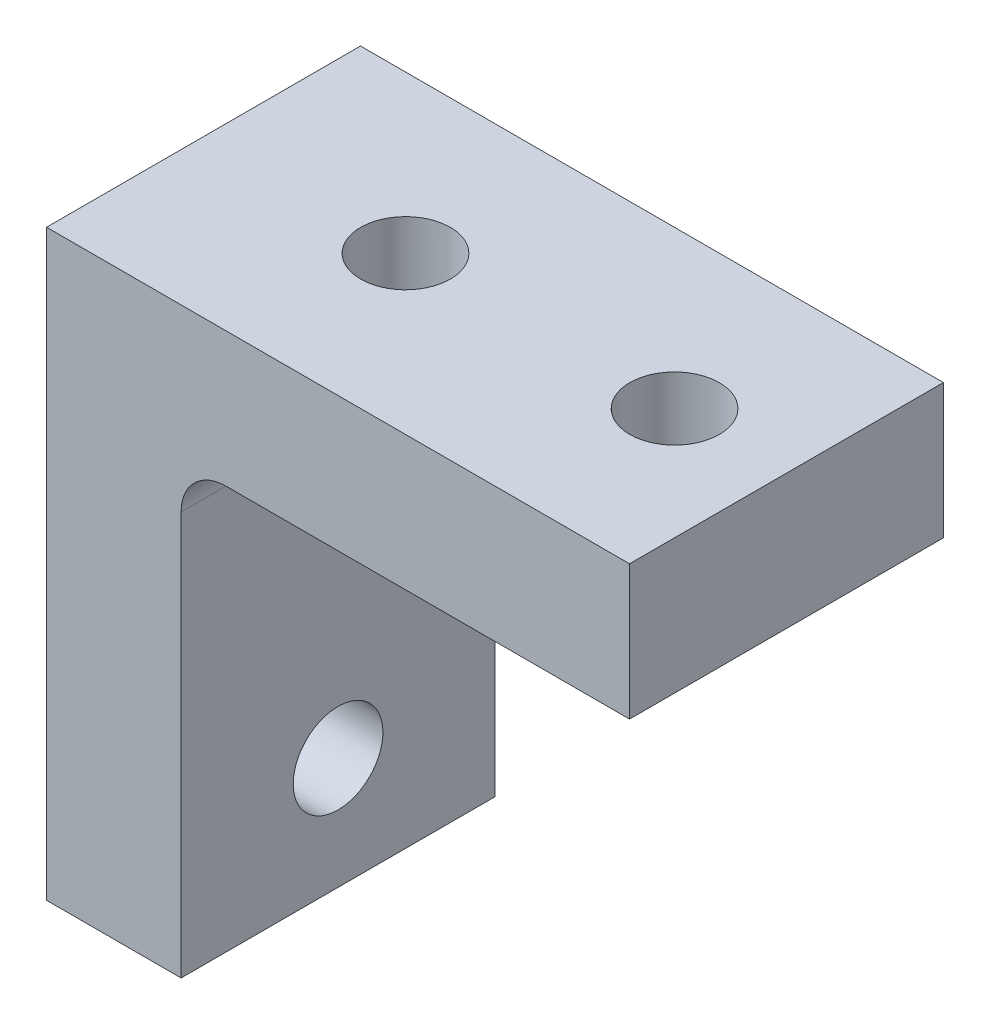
SolidWorks part; units mm, degrees
ref_plane "Front Plane" through (0, 0, 0) normal (0, 0, 1) x (1, 0, 0)
ref_plane "Top Plane" through (0, 0, 0) normal (0, 1, 0) x (1, 0, 0)
ref_plane "Right Plane" through (0, 0, 0) normal (1, 0, 0) x (0, 0, -1)
sketch "Sketch1" plane through (0, 0, 0) normal (0, 0, 1) x (1, 0, 0)
  line L0 (0, 0) -> (0, -41.275)
  line L1 (0, -41.275) -> (9.525, -41.275)
  line L2 (9.525, -41.275) -> (9.525, -9.525)
  line L3 (9.525, -9.525) -> (41.275, -9.525)
  line L4 (41.275, -9.525) -> (41.275, 0)
  line L5 (41.275, 0) -> (0, 0)
  line L6 (0, -33.3502) -> (9.525, -33.3502)
  line L7 (0, -14.3002) -> (9.525, -14.3002)
  line L8 (14.3002, 0) -> (14.3002, -9.525)
  line L9 (33.3502, 0) -> (33.3502, -9.525)
  dimension "D1" = 9.525
  dimension "D2" = 9.525
  dimension "D3" = 41.275
  dimension "D4" = 41.275
  dimension "D5" = 7.9248
  dimension "D6" = 19.05
  dimension "D7" = 7.9248
  dimension "D8" = 19.05
  dimension "D9" = 14.3002
sketch "Sketch2" plane through (0, 0, 0) normal (0, 0, 1) x (1, 0, 0)
  line L0 (0, -41.275) -> (9.525, -41.275) construction
  line L1 (9.525, -41.275) -> (9.525, -9.525) construction
  line L2 (9.525, -9.525) -> (41.275, -9.525) construction
  line L3 (41.275, -9.525) -> (41.275, 0) construction
  line L4 (41.275, 0) -> (0, 0) construction
  line L5 (0, 0) -> (0, -41.275) construction
  line L6 (0, -41.275) -> (9.525, -41.275)
  line L7 (9.525, -41.275) -> (9.525, -9.525)
  line L8 (9.525, -9.525) -> (41.275, -9.525)
  line L9 (41.275, -9.525) -> (41.275, 0)
  line L10 (41.275, 0) -> (0, 0)
  line L11 (0, 0) -> (0, -41.275)
extrude "Boss-Extrude1" add sketch "Sketch2" along normal mid plane 22.225
fillet "Fillet1" radius 3.175 1 edges at (9.525, -9.525, 0)
hole_wizard "1/4 (0.25) Diameter Hole1" positions "Sketch4" profile "Sketch3" hole size "1/4" standard "ANSI Inch"
sketch "Sketch4" plane through (0, 0, 0) normal (-1, 0, 0) x (0, 0, 1)
  point P0 (0, -33.3502)
  point P3 (0, -14.3002)
sketch "Sketch3" plane through (0, -33.3502, 0) normal (0, 1, 0) x (0, 0, 1)
  line L0 (0, 0) -> (0, 22.2277)
  line L1 (0, 22.2277) -> (3.175, 20.32)
  line L2 (3.175, 20.32) -> (3.175, 0)
  line L5 (3.175, 0) -> (0, 0)
  line L10 (0, 22.2277) -> (-3.175, 20.32) construction
  line L11 (0, -6.35) -> (0, 107.95) construction
  dimension "Hole Dia." = 6.35
  dimension "Hole Depth" = 20.32
  dimension "Drill Angle" = 118
hole_wizard "1/4 (0.25) Diameter Hole2" positions "Sketch6" profile "Sketch5" hole size "1/4" standard "ANSI Inch"
sketch "Sketch6" plane through (0, 0, 0) normal (0, 1, 0) x (1, 0, 0)
  point P0 (14.3002, 0)
  point P3 (33.3502, 0)
sketch "Sketch5" plane through (14.3002, 0, 0) normal (1, 0, 0) x (0, 0, 1)
  line L0 (0, 0) -> (0, 22.2277)
  line L1 (0, 22.2277) -> (3.175, 20.32)
  line L2 (3.175, 20.32) -> (3.175, 0)
  line L5 (3.175, 0) -> (0, 0)
  line L10 (0, 22.2277) -> (-3.175, 20.32) construction
  line L11 (0, -6.35) -> (0, 107.95) construction
  dimension "Hole Dia." = 6.35
  dimension "Hole Depth" = 20.32
  dimension "Drill Angle" = 118
